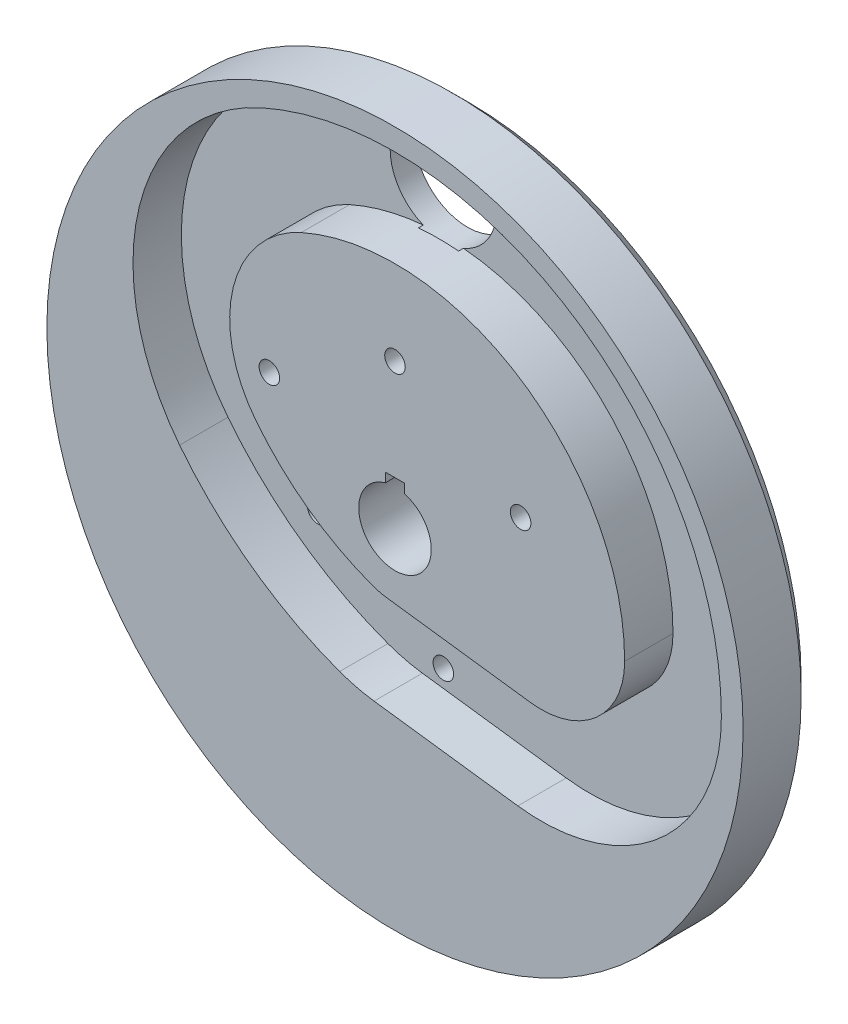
SolidWorks part; units mm, degrees
ref_plane "Face" through (0, 0, 0) normal (0, 0, 1) x (1, 0, 0)
ref_plane "Dessus" through (0, 0, 0) normal (0, 1, 0) x (1, 0, 0)
ref_plane "Droite" through (0, 0, 0) normal (1, 0, 0) x (0, 0, -1)
sketch "Esquisse2" plane through (0, 0, 0) normal (0, 0, 1) x (1, 0, 0)
  circle A0 centre (0, 0) radius 144
  dimension "D1" = 288
extrude "Base-Extrusion" add sketch "Esquisse2" against normal blind 30
sketch "Esquisse1" plane through (0, 0, 0) normal (0, 0, 1) x (1, 0, 0)
  line L0 (0, 158.1458) -> (0, -200) construction
  line L1 (200, 0) -> (-137.0606, 0) construction
  line L2 (-6.0658, -46.2338) -> (53.4105, -54.0369) construction
  line L3 (-55.1098, 123.2395) -> (-81.6408, 182.5781) construction
  line L5 (-0.0114, 0) -> (0.0063, 0.0484) construction
  line L6 (0, 0) -> (0.0063, 0.0484) construction
  line L7 (50.8169, -73.8683) -> (34.6755, -196.9718) construction
  line L8 (-8.6517, -66.0728) -> (50.8169, -73.8683)
  line L9 (-3.4619, -26.4091) -> (56.0161, -34.2058)
  line L10 (-16.0272, -43.7891) -> (-16.0296, -43.7955) construction
  line L11 (-22.8995, -62.5786) -> (-68.7092, -187.8272) construction
  line L12 (-89.0842, -14.5931) -> (-180.3457, -86.4605) construction
  line L13 (-8.6517, -66.0728) -> (-25.9668, -198.3071) construction
  arc A0 (53.4105, -54.0369) -> (115, 0) centre (60.5, 0) ccw construction
  arc A1 (115, 0) -> (-46.6673, 105.1055) centre (0, 0) ccw construction
  arc A2 (-73.37, -2.2213) -> (-16.0296, -43.7955) centre (28.55, 78.02) ccw construction
  arc A3 (-46.6673, 105.1055) -> (-73.37, -2.2213) centre (-18.37, 41.08) ccw construction
  arc A5 (135.0003, 0) -> (-55.1098, 123.2395) centre (0, 0) ccw
  arc A6 (50.8169, -73.8683) -> (135.0003, 0) centre (60.5, 0) ccw
  arc A7 (-38.7803, 86.7225) -> (-57.6543, 10.1516) centre (-18.37, 41.08) ccw
  arc A8 (94.9985, 0) -> (-38.7803, 86.7225) centre (0, 0) ccw
  arc A9 (-55.1098, 123.2395) -> (-89.0842, -14.5931) centre (-18.37, 41.08) ccw
  arc A10 (-57.6543, 10.1516) -> (-9.159, -25.0107) centre (28.55, 78.02) ccw
  arc A11 (-16.0272, -43.7891) -> (-6.0658, -46.2338) centre (0, 0) ccw construction
  arc A12 (-22.8995, -62.5786) -> (-8.6517, -66.0728) centre (0, 0) ccw
  arc A14 (-89.0842, -14.5931) -> (-22.8995, -62.5786) centre (28.55, 78.02) ccw
  arc A15 (56.0161, -34.2058) -> (94.9985, 0) centre (60.5, 0) ccw
  arc A16 (-9.159, -25.0107) -> (-3.4619, -26.4091) centre (0, 0) ccw
  arc A18 (-16.0272, -43.7891) -> (-6.0658, -46.2338) centre (0, 0) ccw construction
  dimension "D6" = 31.69
  dimension "D7" = 230
  dimension "D8" = 114.09
  dimension "D9" = 140
  dimension "D10" = 104.13
  dimension "D15" = 26.635
  dimension "D18" = 180
  dimension "D11" = 46.63
  dimension "D12" = 12.63
  dimension "D13" = 97.47
extrude "Enlèv. mat.-Extru.1" cut sketch "Esquisse1" against normal blind 20
sketch "Esquisse3" plane through (0, 0, 0) normal (0, 0, 1) x (1, 0, 0)
  line L0 (-4, 18.3) -> (-4, 14.4568)
  line L1 (-4, 18.3) -> (4, 18.3)
  line L2 (4, 18.3) -> (4, 14.4568)
  arc A0 (-4, 14.4568) -> (4, 14.4568) centre (0, 0) ccw
  dimension "D1" = 30
  dimension "D2" = 4
  dimension "D3" = 4
  dimension "D4" = 18.3
extrude "Enlèv. mat.-Extru.2" cut sketch "Esquisse3" against normal through all
sketch "Esquisse4" plane through (0, 0, 0) normal (0, 0, 1) x (1, 0, 0)
  line L0 (0, 224.5301) -> (0, -290.0755) construction
  line L1 (-230.0445, 0) -> (294.6514, 0) construction
  line L2 (217.9501, 125.8336) -> (-217.9501, -125.8336) construction
  line L3 (0, 0) -> (-264.6385, 152.7891) construction
  circle A0 centre (0, 0) radius 60 construction
  dimension "D1" = 120
  dimension "D2" = 60
  dimension "D3" = 60
hole_wizard "Trou taraudé M10x1.51" positions "Esquisse3D4" profile "Esquisse8" tap size "M10x1.5" standard "ISO"
sketch3d "Esquisse3D4"
  line L0 (0, 224.5301, 0) -> (0, -290.0755, 0) construction
  line L1 (0, 0, 0) -> (-264.6385, 152.7891, 0) construction
  line L2 (217.9501, 125.8336, 0) -> (-217.9501, -125.8336, 0) construction
  circle A0 centre (0, 0, 0) radius 60 construction
  point P0 (0, 60, 0)
  point P1 (51.9615, 30, 0)
  point P2 (-51.9615, 30, 0)
  point P7 (0, 0, 60)
sketch "Esquisse8" plane through (0, 60, 0) normal (1, 0, 0) x (0, -1, 0)
  line L0 (0, 0) -> (0, 30)
  line L1 (0, 30) -> (4.25, 30)
  line L2 (4.25, 30) -> (4.25, 0)
  line L5 (4.25, 0) -> (0, 0)
  line L11 (0, -6.35) -> (0, 107.95) construction
  dimension "Diamètre du perçage jusqu'au prochain" = 8.5
  dimension "Profondeur du perçage jusqu'au prochain" = 30
sketch "Esquisse9" plane through (0, 0, -20) normal (0, 0, 1) x (1, 0, 0)
  line L0 (-217.9501, -125.8336) -> (205.7801, 118.8072) construction
  line L1 (217.9501, 125.8336) -> (-217.9501, -125.8336) construction
  line L2 (0, 0) -> (0, -234.0308) construction
  line L4 (0, 224.5301) -> (0, -290.0755) construction
  circle A0 centre (0, 0) radius 60 construction
  dimension "D1" = 120
hole_wizard "Trou taraudé M10x1.52" positions "Esquisse3D5" profile "Esquisse10" tap size "M10x1.5" standard "ISO"
sketch3d "Esquisse3D5"
  line L0 (0, 0, -20) -> (0, -234.0308, -20) construction
  line L1 (-217.9501, -125.8336, -20) -> (205.7801, 118.8072, -20) construction
  circle A0 centre (0, 0, -20) radius 60 construction
  point P0 (-51.9615, -30, -20)
  point P1 (0, -60, -20)
  point P6 (0, 0, 40)
sketch "Esquisse10" plane through (-51.9615, -30, -20) normal (1, 0, 0) x (0, -1, 0)
  line L0 (0, 0) -> (0, 30.0537)
  line L1 (0, 30.0537) -> (4.25, 27.5)
  line L2 (4.25, 27.5) -> (4.25, 0)
  line L5 (4.25, 0) -> (0, 0)
  line L10 (0, 30.0537) -> (-4.25, 27.5) construction
  line L11 (0, -6.35) -> (0, 107.95) construction
  dimension "Diamètre du perçage" = 8.5
  dimension "Profondeur du perçage" = 27.5
  dimension "Angle de pointe" = 118
hole_wizard "Trou taraudé M10x1.53" positions "Esquisse3D6" profile "Esquisse11" tap size "M10x1.5" standard "ISO"
sketch3d "Esquisse3D6"
  line L0 (0, 0, -20) -> (0, -234.0308, -20) construction
  circle A0 centre (0, 0, -20) radius 60 construction
  point P0 (0, -60, -20)
  point P3 (0, 0, 40)
sketch "Esquisse11" plane through (0, -60, -20) normal (1, 0, 0) x (0, -1, 0)
  line L0 (0, 0) -> (0, 10)
  line L1 (0, 10) -> (4.25, 10)
  line L2 (4.25, 10) -> (4.25, 0)
  line L5 (4.25, 0) -> (0, 0)
  line L11 (0, -6.35) -> (0, 107.95) construction
  dimension "Diamètre du perçage jusqu'au prochain" = 8.5
  dimension "Profondeur du perçage jusqu'au prochain" = 10
sketch "Esquisse12" plane through (0, 0, -30) normal (0, 0, -1) x (-1, 0, 0)
  line L0 (0, 222.0466) -> (0, -289.0945) construction
  circle A0 centre (0, 0) radius 115 construction
  circle A1 centre (0, 115) radius 22
  dimension "D1" = 230
  dimension "D2" = 44
extrude "Enlèv. mat.-Extru.3" cut sketch "Esquisse12" against normal blind 12
chamfer "Chanfrein6" distance 6 angle 45
sketch "Esquisse13" plane through (0, 0, 0) normal (0, 0, 1) x (1, 0, 0)
  line L0 (0, 0) -> (94.9985, 0) construction
  line L1 (0, 0) -> (-38.7803, 86.7225) construction
